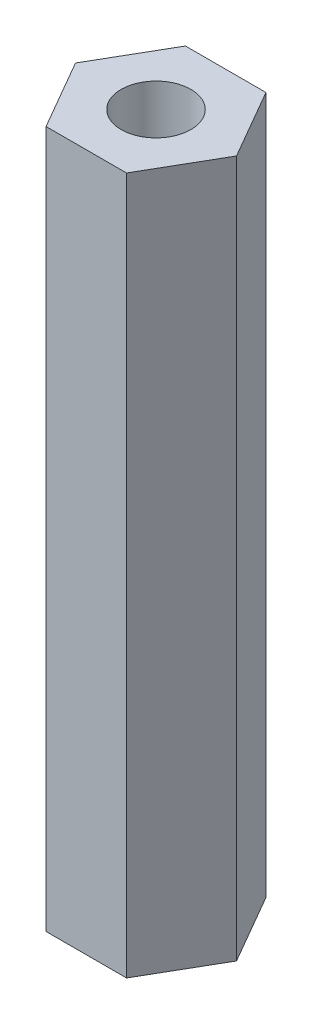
SolidWorks part; units mm, degrees
ref_plane "Front" through (0, 0, 0) normal (0, 0, 1) x (1, 0, 0)
ref_plane "Top" through (0, 0, 0) normal (0, 1, 0) x (1, 0, 0)
ref_plane "Right" through (0, 0, 0) normal (1, 0, 0) x (0, 0, -1)
sketch "草图1" plane through (0, 0, 0) normal (0, 1, 0) x (1, 0, 0)
  line L1 (3.4641, 0) -> (1.7321, 3)
  line L2 (1.7321, 3) -> (-1.7321, 3)
  line L3 (-1.7321, 3) -> (-3.4641, 0)
  line L4 (-3.4641, 0) -> (-1.7321, -3)
  line L5 (-1.7321, -3) -> (1.7321, -3)
  line L6 (1.7321, -3) -> (3.4641, 0)
  circle A0 centre (0, 0) radius 3 construction
  circle A1 centre (0, 0) radius 1.5
  dimension "D1" = 3
  dimension "D2" = 6
extrude "凸台-拉伸1" add sketch "草图1" along normal blind 30
